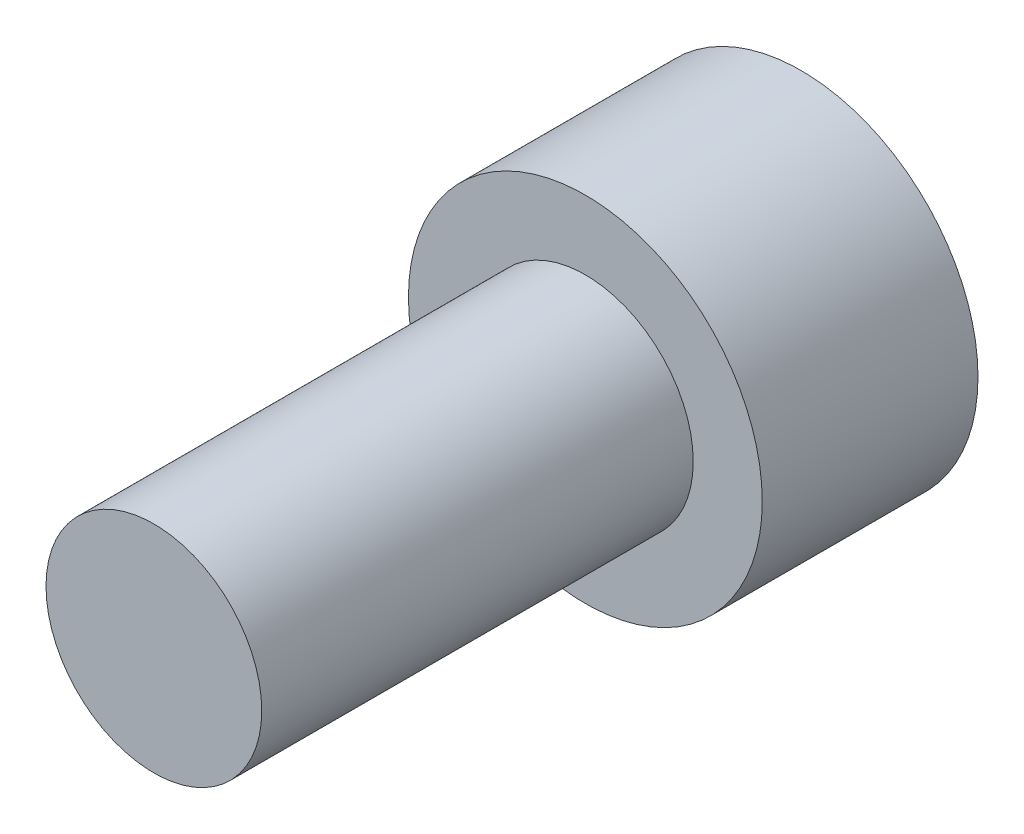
SolidWorks part; units mm, degrees
ref_plane "Front Plane" through (0, 0, 0) normal (0, 0, 1) x (1, 0, 0)
ref_plane "Top Plane" through (0, 0, 0) normal (0, 1, 0) x (1, 0, 0)
ref_plane "Right Plane" through (0, 0, 0) normal (1, 0, 0) x (0, 0, -1)
sketch "Sketch6" plane through (0, 0, 0) normal (1, 0, 0) x (0, 0, -1)
  line L0 (-6.35, 0) -> (22.525, 0) construction
  line L1 (2.8638, 0) -> (-2.8638, 0) construction
  line L2 (-6.35, 0) -> (-6.35, -1.5875)
  line L3 (-6.35, -1.5875) -> (0, -1.5875)
  line L4 (0, 2.8638) -> (0, -2.8638) construction
  line L5 (0, -1.5875) -> (0, -2.6035)
  line L6 (0, -2.6035) -> (3.175, -2.6035)
  line L7 (3.175, -2.6035) -> (3.175, 0)
  line L8 (3.175, 0) -> (-6.35, 0)
  dimension "L" = 6.35
  dimension "H" = 3.175
  dimension "A" = 5.207
  dimension "D" = 3.175
revolve "Revolve1" add sketch "Sketch6" angle 360 about L0
sketch "Sketch7" plane through (0, 0, -3.175) normal (0, 0, -1) x (-1, 0, 0)
  line L2 (-1.1811, 0.6819) -> (-1.1811, -0.6819)
  line L4 (-1.1811, -0.6819) -> (0, -1.3638)
  line L5 (0, -1.3638) -> (1.1811, -0.6819)
  line L6 (1.1811, -0.6819) -> (1.1811, 0.6819)
  line L7 (1.1811, 0.6819) -> (0, 1.3638)
  line L8 (0, 1.3638) -> (-1.1811, 0.6819)
  circle A0 centre (0, 0) radius 1.1811 construction
  dimension "J" = 2.3622
extrude "HEX" cut sketch "Sketch7" against normal blind 1.778
